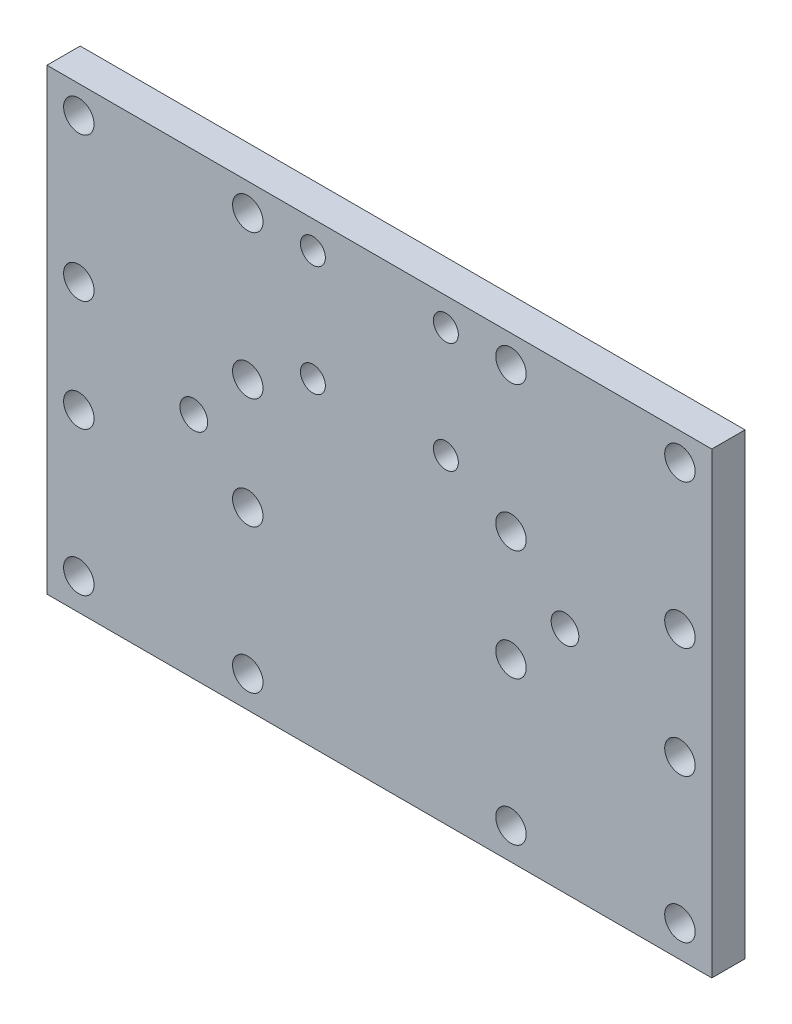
SolidWorks part; units mm, degrees
ref_plane "Alzado" through (0, 0, 0) normal (0, 0, 1) x (1, 0, 0)
ref_plane "Planta" through (0, 0, 0) normal (0, 1, 0) x (1, 0, 0)
ref_plane "Vista lateral" through (0, 0, 0) normal (1, 0, 0) x (0, 0, -1)
sketch "Croquis1" plane through (0, 0, 0) normal (0, 0, 1) x (1, 0, 0)
  line L2 (-658.2529, 281.4731) -> (-538.2529, 281.4731)
  line L3 (-658.2529, 281.4731) -> (-658.2529, 198.7873)
  line L4 (-658.2529, 198.7873) -> (-538.2529, 198.7873)
  line L5 (-538.2529, 281.4731) -> (-538.2529, 198.7873)
  circle A0 centre (-652.5029, 276.4731) radius 2.75
  circle A1 centre (-622.0029, 276.4731) radius 2.75
  circle A2 centre (-610.2529, 276.4731) radius 2.25
  circle A3 centre (-586.2529, 276.4731) radius 2.25
  circle A4 centre (-574.5029, 276.4731) radius 2.75
  circle A5 centre (-544.0029, 276.4731) radius 2.75
  circle A6 centre (-544.0029, 250.4731) radius 2.75
  circle A7 centre (-574.5029, 250.4731) radius 2.75
  circle A8 centre (-586.2529, 256.4731) radius 2.25
  circle A9 centre (-610.2529, 256.4731) radius 2.25
  circle A10 centre (-622.0029, 250.4731) radius 2.75
  circle A11 centre (-652.5029, 250.4731) radius 2.75
  circle A12 centre (-652.5029, 230.4731) radius 2.75
  circle A13 centre (-622.0029, 230.4731) radius 2.75
  circle A14 centre (-652.5029, 204.4731) radius 2.75
  circle A15 centre (-622.0029, 204.4731) radius 2.75
  circle A16 centre (-574.5029, 230.4731) radius 2.75
  circle A17 centre (-574.5029, 204.4731) radius 2.75
  circle A18 centre (-544.0029, 204.4731) radius 2.75
  circle A19 centre (-544.0029, 230.4731) radius 2.75
  dimension "D1" = 5.5
  dimension "D2" = 4.5
extrude "Saliente-Extruir1" add sketch "Croquis1" along normal blind 6
sketch "Croquis2" plane through (0, 0, 6) normal (0, 0, 1) x (1, 0, 0)
  line L0 (-610.2529, 274.2231) -> (-610.2529, 258.7231) construction
  line L3 (-658.2529, 240.1302) -> (-538.2529, 240.1302) construction
  line L4 (-658.2529, 281.4731) -> (-658.2529, 198.7873) construction
  line L5 (-538.2529, 198.7873) -> (-538.2529, 281.4731) construction
  circle A0 centre (-610.2529, 276.4731) radius 2.25 construction
  circle A1 centre (-610.2529, 256.4731) radius 2.25 construction
  circle A2 centre (-631.7529, 240.1302) radius 2.5
  circle A3 centre (-564.7529, 240.1302) radius 2.5
  point P16 (-598.2529, 240.1302)
  dimension "D1" = 5
  dimension "D2" = 5
  dimension "D3" = 67
  dimension "D4" = 33.5
extrude "Cortar-Extruir1" cut sketch "Croquis2" against normal blind 6
sketch "Croquis3" plane through (0, 0, 0) normal (0, 0, -1) x (-1, 0, 0)
  line L0 (598.2529, 281.4731) -> (598.2529, 198.7873) construction
  line L1 (538.2529, 281.4731) -> (658.2529, 281.4731) construction
  line L2 (658.2529, 198.7873) -> (538.2529, 198.7873) construction
  line L4 (558.2529, 220.1302) -> (638.2529, 220.1302)
  line L5 (558.2529, 220.1302) -> (558.2529, 260.1302)
  line L6 (558.2529, 260.1302) -> (638.2529, 260.1302)
  line L7 (638.2529, 220.1302) -> (638.2529, 260.1302)
  line L8 (558.2529, 220.1302) -> (638.2529, 260.1302) construction
  line L9 (558.2529, 260.1302) -> (638.2529, 220.1302) construction
  circle A0 centre (564.7529, 240.1302) radius 2.4859
  circle A1 centre (631.7529, 240.1302) radius 2.535
  point P6 (598.2529, 240.1302)
  dimension "D1" = 40
  dimension "D2" = 80
